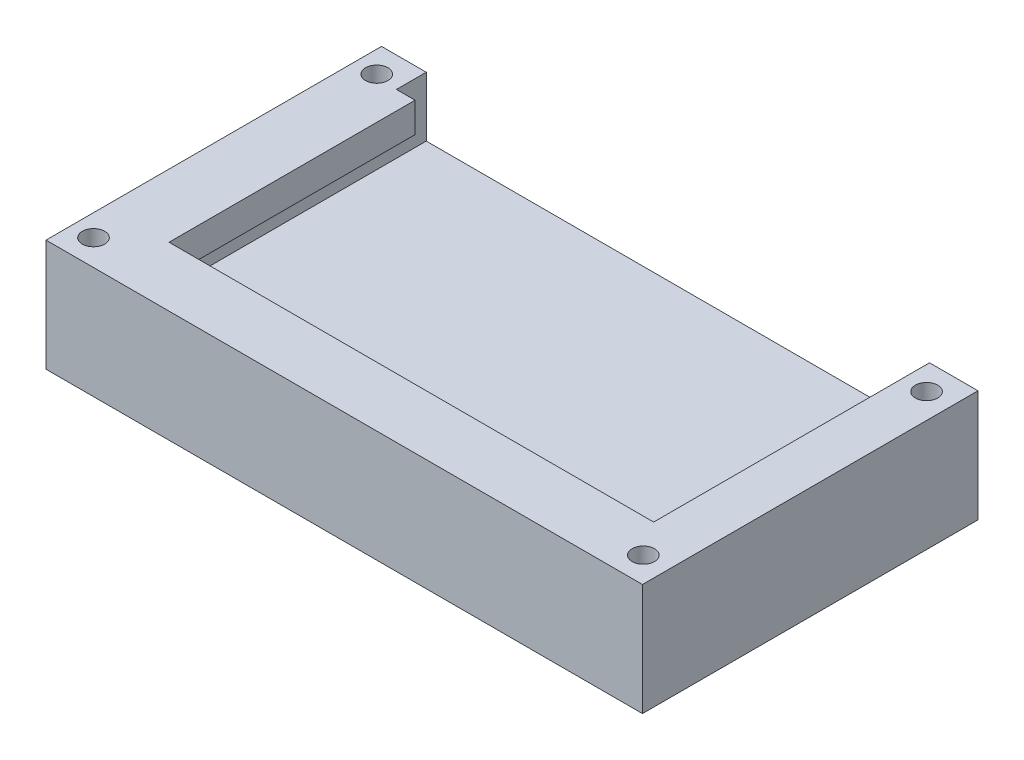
SolidWorks part; units mm, degrees
ref_plane "Front Plane" through (0, 0, 0) normal (0, 0, 1) x (1, 0, 0)
ref_plane "Top Plane" through (0, 0, 0) normal (0, 1, 0) x (1, 0, 0)
ref_plane "Right Plane" through (0, 0, 0) normal (1, 0, 0) x (0, 0, -1)
sketch "Sketch1" plane through (0, 0, 0) normal (0, 1, 0) x (1, 0, 0)
  line L0 (0, 0) -> (0, 45)
  line L1 (0, 45) -> (80, 45)
  line L2 (80, 45) -> (80, 0)
  line L3 (80, 0) -> (0, 0)
  line L4 (40, 44.9873) -> (40, -14.6387) construction
  point P9 (4.5701, 39.8459)
  dimension "D1" = 80
  dimension "D2" = 45
extrude "Boss-Extrude1" add sketch "Sketch1" along normal blind 15
sketch "Sketch2" plane through (0, 15, 0) normal (0, 1, 0) x (1, 0, 0)
  line L0 (80, 45) -> (0, 45) construction
  line L1 (6, 45) -> (73.5, 45)
  line L2 (6, 45) -> (6, 8)
  line L3 (6, 8) -> (73.5, 8)
  line L4 (73.5, 45) -> (73.5, 8)
  line L5 (0, 45) -> (0, 0) construction
  line L7 (0, 0) -> (80, 0) construction
  dimension "D1" = 67.5
  dimension "D2" = 8
  dimension "D4" = 6
extrude "Cut-Extrude1" cut sketch "Sketch2" against normal blind 8
sketch "Sketch4" plane through (0, 15, 0) normal (0, 1, 0) x (1, 0, 0)
  line L1 (6, 8) -> (8.5, 8)
  line L2 (6, 8) -> (6, 41)
  line L3 (6, 41) -> (8.5, 41)
  line L4 (8.5, 8) -> (8.5, 41)
  dimension "D1" = 33
  dimension "D2" = 2.5
extrude "Boss-Extrude2" add sketch "Sketch4" against normal blind 4
sketch "Sketch5" plane through (0, 15, 0) normal (0, 1, 0) x (1, 0, 0)
  circle A0 centre (2.9054, 41.4534) radius 1.5
  circle A1 centre (76.6483, 3.467) radius 1.5
  circle A2 centre (76.6483, 41.4534) radius 1.5
  circle A3 centre (2.9054, 3.467) radius 1.5
  point P8 (76.6483, 41.4534)
  point P9 (76.6483, 3.467)
  point P10 (2.9054, 3.467)
  dimension "D1" = 3
  dimension "D2" = 3
  dimension "D3" = 3
  dimension "D4" = 3
extrude "Cut-Extrude2" cut sketch "Sketch5" against normal through all both and the other way through all
